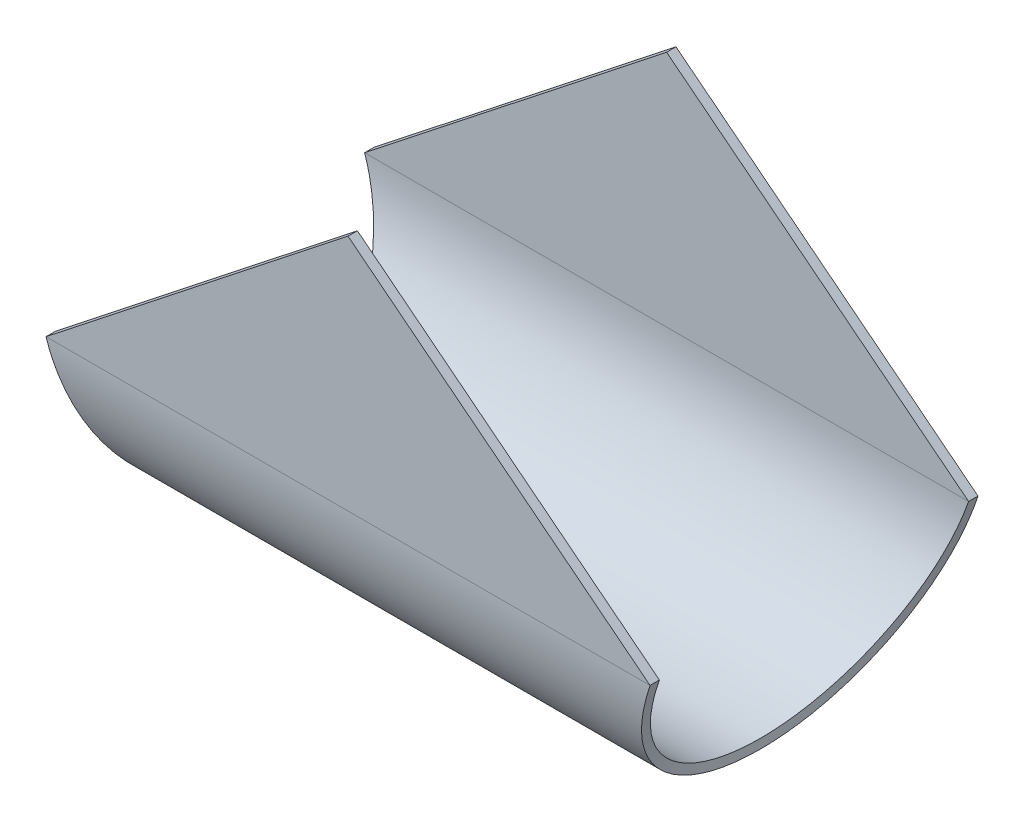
SolidWorks part; units mm, degrees
ref_plane "前视基准面" through (0, 0, 0) normal (0, 0, 1) x (1, 0, 0)
ref_plane "上视基准面" through (0, 0, 0) normal (0, 1, 0) x (1, 0, 0)
ref_plane "右视基准面" through (0, 0, 0) normal (1, 0, 0) x (0, 0, -1)
imported_body "基体零件-带补料的任意角Y形三通管-1"
sheet metal parameters "钣金1" parameters "D1"=0.7366, "厚度"=1
bend "圆角折弯1" bend radius 16.4845 bend angle 180 parameters "D5"=1
flatten bends "展开-折弯1"
sketch "尖角-草图1" plane through (0, 0, -16.4845) normal (0, 0, 1) x (1, 0, 0)
  line L0 (-32.2002, -51.2738) -> (32.2002, -51.2738) construction
  dimension "D1" = 0
process bends "加工-折弯1" parameters "D1"=0
sketch "平面-草图1" plane through (0, 0, -16.4845) normal (0, 0, 1) x (1, 0, 0)
flat pattern "平板型式1"
sketch "折弯-线1" plane through (0, 0, 0) normal (0, 1, 0) x (-1, 0, 0)
bend of the flat pattern "展开-<圆角折弯1>1"
